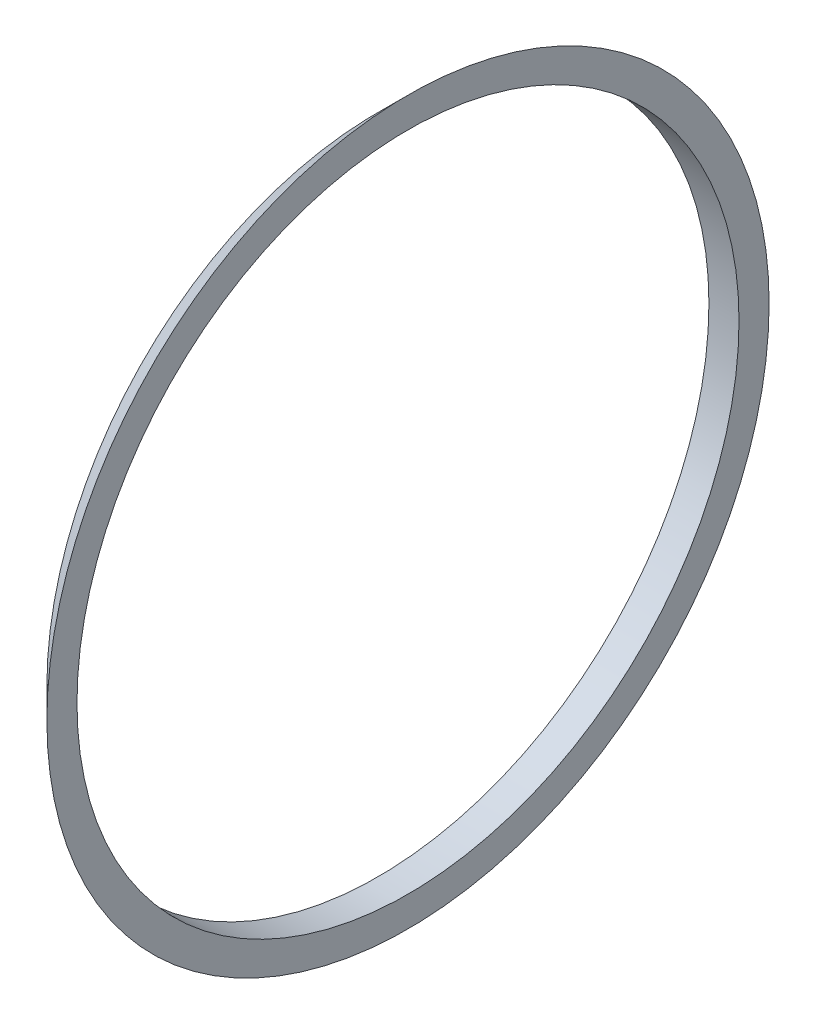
SolidWorks part; units mm, degrees
ref_plane "Plan1" through (0, 0, 0) normal (0, 0, 1) x (1, 0, 0)
ref_plane "Plan2" through (0, 0, 0) normal (0, 1, 0) x (1, 0, 0)
ref_plane "Plan3" through (0, 0, 0) normal (1, 0, 0) x (0, 0, -1)
sketch "Esquisse1" plane through (0, 0, 0) normal (0, 0, 1) x (1, 0, 0)
  line L0 (-32.1995, 33) -> (-29.1995, 33)
  line L1 (-29.1995, 33) -> (-29.1995, 36)
  line L2 (-29.1995, 36) -> (-32.1995, 33)
  line L3 (0, 0) -> (-40, 0) construction
  dimension "D1" = 33
  dimension "D2" = 29.1995
  dimension "D3" = 3
  dimension "D4" = 45
revolve "Base-Révolution" add sketch "Esquisse1" angle 360 about L3
